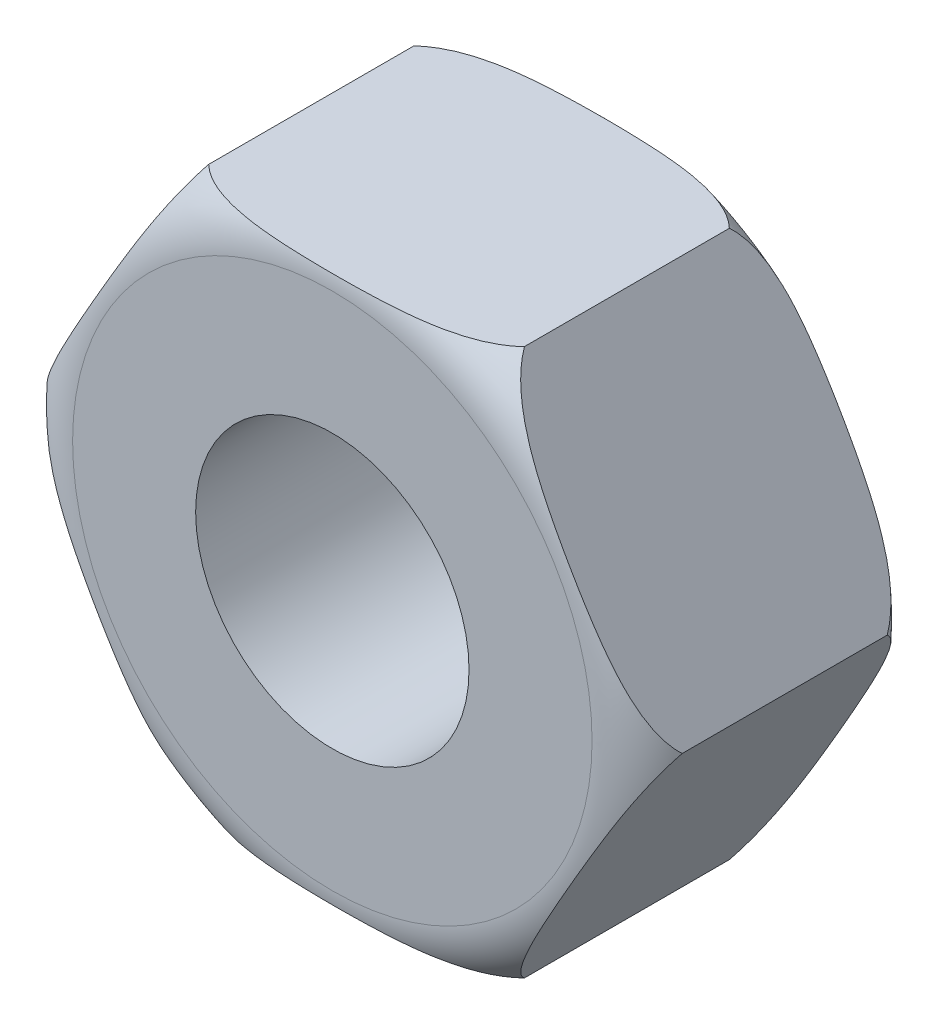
SolidWorks part; units mm, degrees
ref_plane "Plan de face" through (0, 0, 0) normal (0, 0, 1) x (1, 0, 0)
ref_plane "Plan de dessus" through (0, 0, 0) normal (0, 1, 0) x (1, 0, 0)
ref_plane "Plan de droite" through (0, 0, 0) normal (1, 0, 0) x (0, 0, -1)
sketch "Esquisse1" plane through (0, 0, 0) normal (0, 0, 1) x (1, 0, 0)
  circle A0 centre (0, 0) radius 5.9
  circle A1 centre (0, 0) radius 2.5
extrude "Extrusion1" add sketch "Esquisse1" along normal blind 5
fillet "Congé1" radius 1.15 2 edges at (5.9, 0, 0) (5.9, 0, 5)
sketch "Esquisse2" plane through (0, 0, 0) normal (0, 0, 1) x (1, 0, 0)
  line L0 (-5.7186, 5) -> (4.9825, 5) construction
  line L1 (-7.1894, -2.4525) -> (-1.8389, 6.8149) construction
  line L2 (-1.4708, -7.4525) -> (-6.8214, 1.8149) construction
  line L3 (5.7186, -5) -> (-4.9825, -5) construction
  line L4 (7.1894, 2.4525) -> (1.8389, -6.8149) construction
  line L5 (1.4708, 7.4525) -> (6.8214, -1.8149) construction
  line L6 (2.8868, 5) -> (-2.8868, 5)
  line L7 (-2.8868, 5) -> (-5.7735, 0)
  line L8 (-5.7735, 0) -> (-2.8868, -5)
  line L9 (-2.8868, -5) -> (2.8868, -5)
  line L10 (2.8868, -5) -> (5.7735, 0)
  line L11 (5.7735, 0) -> (2.8868, 5)
extrude "Enlèv. mat.-Extru.2" cut sketch "Esquisse2" along normal blind 6 flip side to cut
